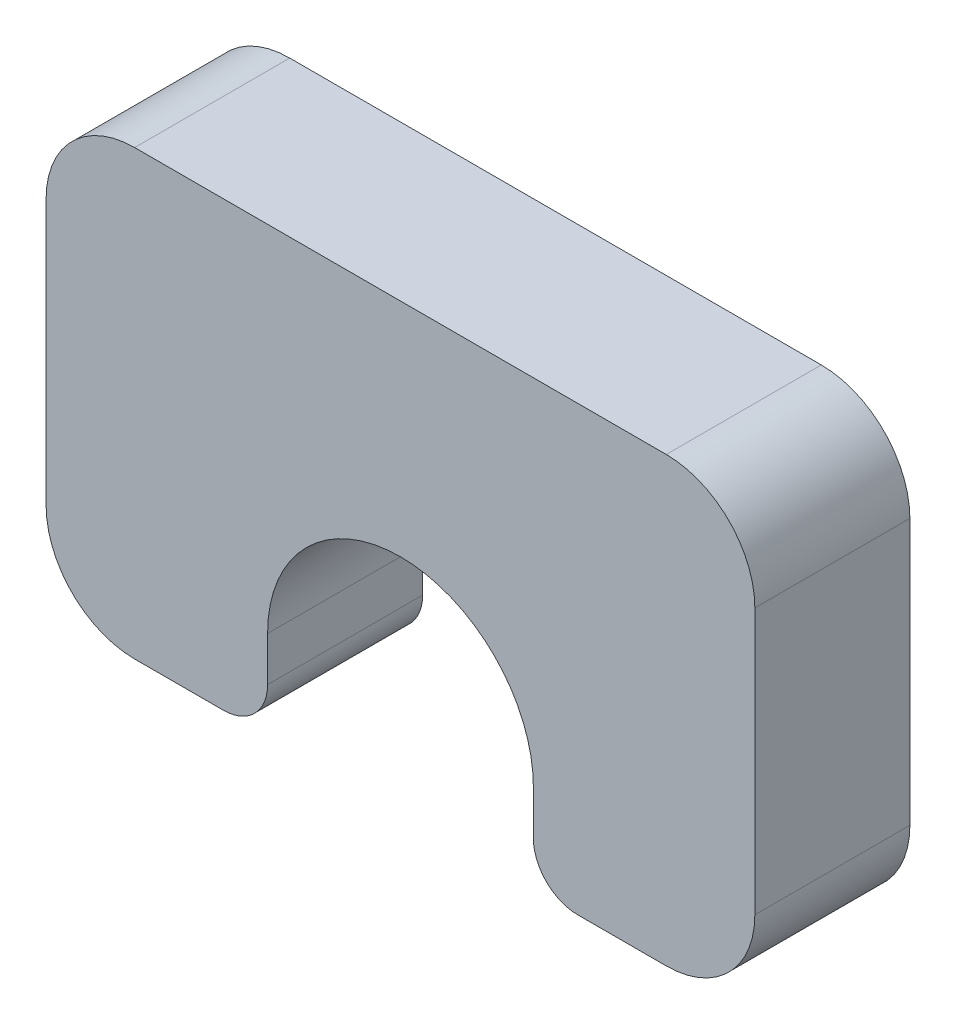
SolidWorks part; units mm, degrees
ref_plane "Front Plane" through (0, 0, 0) normal (0, 0, 1) x (1, 0, 0)
ref_plane "Top Plane" through (0, 0, 0) normal (0, 1, 0) x (1, 0, 0)
ref_plane "Right Plane" through (0, 0, 0) normal (1, 0, 0) x (0, 0, -1)
sketch "Sketch1" plane through (0, 0, 0) normal (0, 0, 1) x (1, 0, 0)
  line L1 (2, 0) -> (4, 0)
  line L2 (0, 2) -> (0, 8)
  line L3 (2, 10) -> (14, 10)
  line L4 (16, 2) -> (16, 8)
  line L5 (5, 2) -> (5, 1)
  line L6 (11, 2) -> (11, 1)
  line L7 (12, 0) -> (14, 0)
  arc A0 (14, 0) -> (16, 2) centre (14, 2) ccw
  arc A1 (14, 10) -> (16, 8) centre (14, 8) cw
  arc A2 (0, 8) -> (2, 10) centre (2, 8) cw
  arc A3 (2, 0) -> (0, 2) centre (2, 2) cw
  arc A4 (11, 2) -> (5, 2) centre (8, 2) ccw
  arc A5 (11, 1) -> (12, 0) centre (12, 1) ccw
  arc A6 (5, 1) -> (4, 0) centre (4, 1) cw
  point P7 (16, 0)
  point P12 (0, 10)
  point P15 (0, 0)
  point P23 (11, 0)
  point P26 (8, 10)
  dimension "D3" = 2
  dimension "D5" = 6
  dimension "D7" = 1
  dimension "D1" = 16
  dimension "D2" = 10
  dimension "D4" = 2
extrude "Boss-Extrude1" add sketch "Sketch1" along normal blind 3.5
